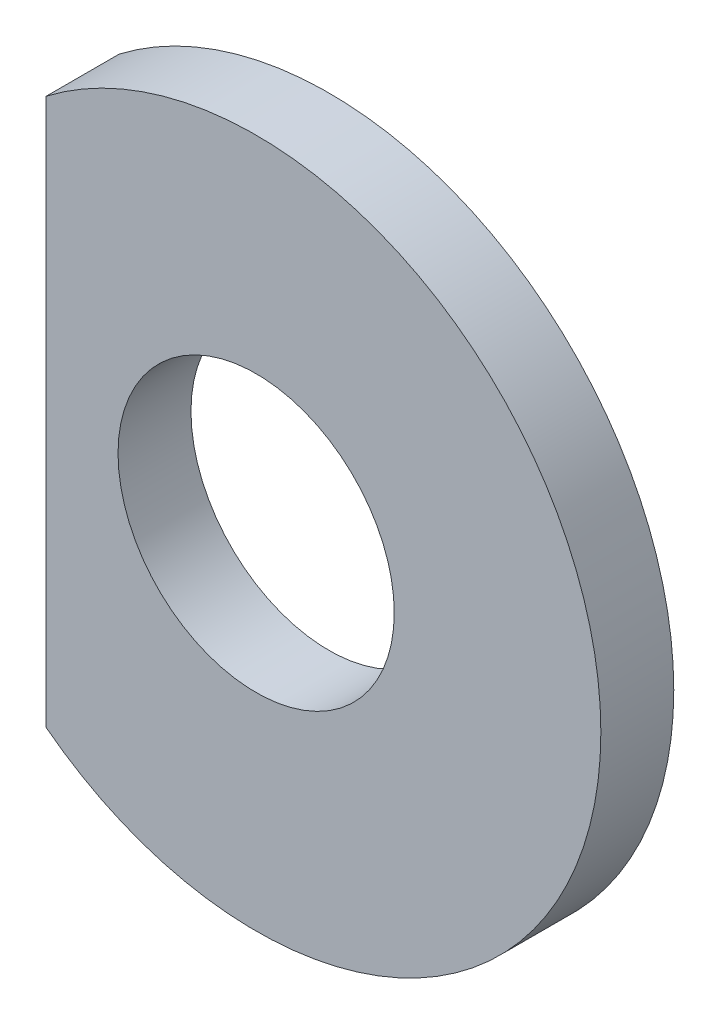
SolidWorks part; units mm, degrees
ref_plane "Front Plane" through (0, 0, 0) normal (0, 0, 1) x (1, 0, 0)
ref_plane "Top Plane" through (0, 0, 0) normal (0, 1, 0) x (1, 0, 0)
ref_plane "Right Plane" through (0, 0, 0) normal (1, 0, 0) x (0, 0, -1)
sketch "Sketch1" plane through (0, 0, 0) normal (0, 0, 1) x (1, 0, 0)
  line L0 (-2.413, 3.1429) -> (-2.413, -3.1429)
  line L1 (0, -3.9624) -> (0, 3.9624) construction
  circle A0 centre (0, 0) radius 1.5875
  arc A1 (-2.413, -3.1429) -> (-2.413, 3.1429) centre (0, 0) ccw
  dimension "ID" = 3.175
  dimension "OD" = 7.9248
  dimension "B" = 6.3754
extrude "Extrude1" add sketch "Sketch1" against normal blind 0.8382
